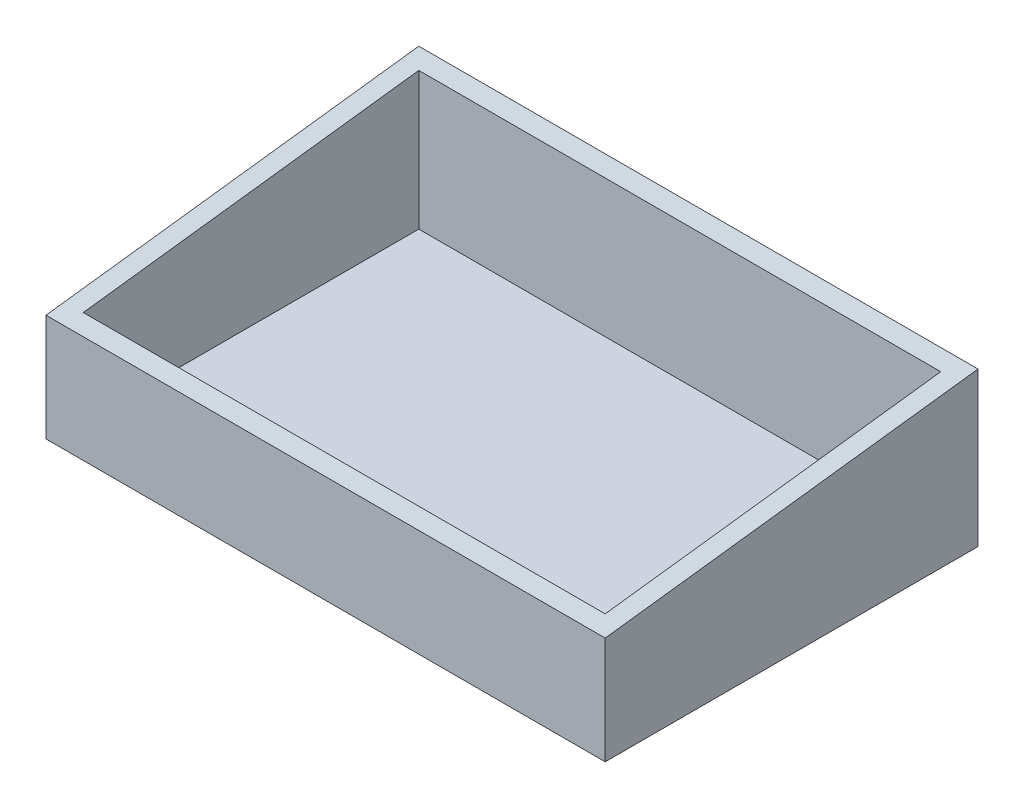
SolidWorks part; units mm, degrees
ref_plane "Plan de face" through (0, 0, 0) normal (0, 0, 1) x (1, 0, 0)
ref_plane "Plan de dessus" through (0, 0, 0) normal (0, 1, 0) x (1, 0, 0)
ref_plane "Plan de droite" through (0, 0, 0) normal (1, 0, 0) x (0, 0, -1)
sketch "Esquisse1" plane through (0, 0, 0) normal (1, 0, 0) x (0, 0, -1)
  line L1 (0, 0) -> (-400, 0)
  line L2 (0, 0) -> (0, 165)
  line L3 (0, 165) -> (-400, 165)
  line L4 (-400, 0) -> (-400, 165)
  dimension "D1" = 165
  dimension "D2" = 400
extrude "Extrusion1" add sketch "Esquisse1" against normal blind 600
sketch "Esquisse2" plane through (0, 165, 0) normal (0, 1, 0) x (1, 0, 0)
  line L0 (-600, 0) -> (-600, -400) construction
  line L1 (-580, -20) -> (-20, -20)
  line L2 (-580, -20) -> (-580, -380)
  line L3 (-580, -380) -> (-20, -380)
  line L4 (-20, -20) -> (-20, -380)
  line L5 (-600, 0) -> (0, 0) construction
  line L6 (0, 0) -> (0, -400) construction
  line L7 (-600, -400) -> (0, -400) construction
  dimension "D1" = 20
  dimension "D2" = 20
  dimension "D3" = 20
  dimension "D4" = 20
sketch "Esquisse3" plane through (-600, 0, 0) normal (-1, 0, 0) x (0, 0, 1)
  line L0 (0, 165) -> (400, 115)
  line L1 (400, 165) -> (400, 0) construction
  dimension "D1" = 50
extrude "Extrusion3" cut sketch "Esquisse3" against normal through all and the other way through all
extrude "Extrusion4" cut sketch "Esquisse2" against normal blind 150
